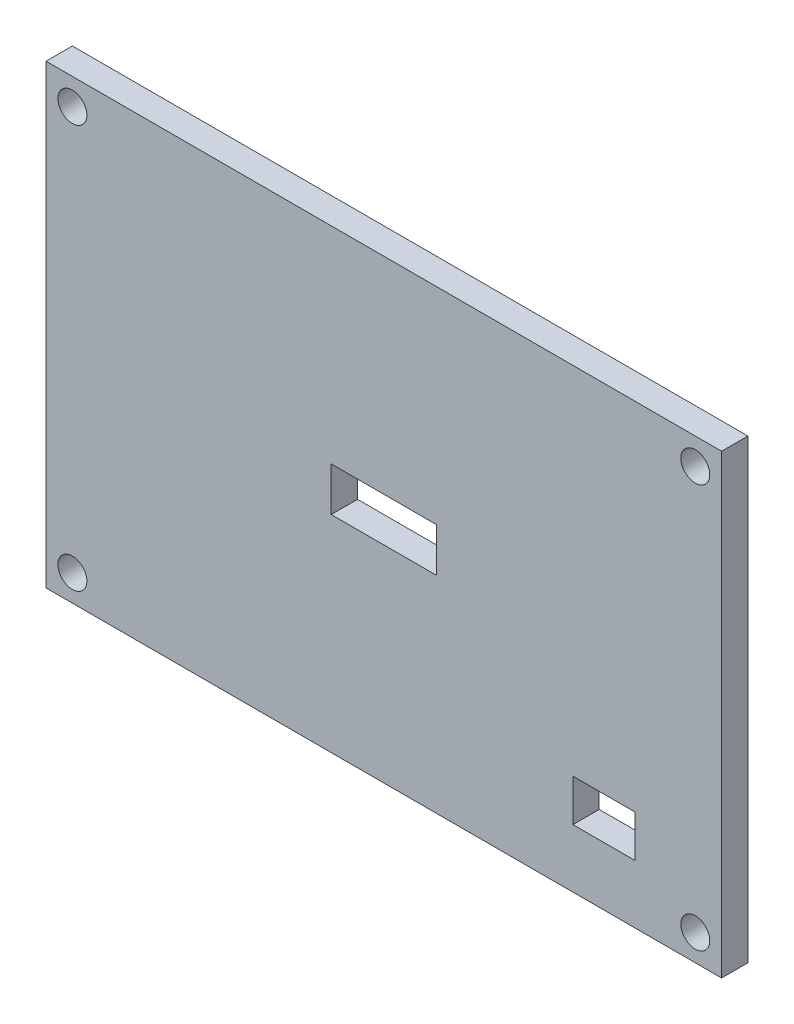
SolidWorks part; units mm, degrees
ref_plane "Alzado" through (0, 0, 0) normal (0, 0, 1) x (1, 0, 0)
ref_plane "Planta" through (0, 0, 0) normal (0, 1, 0) x (1, 0, 0)
ref_plane "Vista lateral" through (0, 0, 0) normal (1, 0, 0) x (0, 0, -1)
sketch "Croquis1" plane through (0, 0, 0) normal (0, 0, 1) x (1, 0, 0)
  line L0 (0, 0) -> (17.082, 0) construction
  line L1 (-38.5, -26) -> (38.5, -26)
  line L2 (-38.5, -26) -> (-38.5, 26)
  line L3 (-38.5, 26) -> (38.5, 26)
  line L4 (38.5, -26) -> (38.5, 26)
  line L5 (-38.5, -26) -> (38.5, 26) construction
  line L6 (-38.5, 26) -> (38.5, -26) construction
  line L7 (0, 0) -> (0, 14.9342) construction
  line L9 (-6, -2.5) -> (6, -2.5)
  line L10 (-6, -2.5) -> (-6, 2.5)
  line L11 (-6, 2.5) -> (6, 2.5)
  line L12 (6, -2.5) -> (6, 2.5)
  line L13 (-6, -2.5) -> (6, 2.5) construction
  line L14 (-6, 2.5) -> (6, -2.5) construction
  line L15 (28.6303, -19.3347) -> (21.5498, -19.3347)
  line L16 (28.6303, -19.3347) -> (28.6303, -14.5531)
  line L17 (28.6303, -14.5531) -> (21.5498, -14.5531)
  line L18 (21.5498, -19.3347) -> (21.5498, -14.5531)
  circle A0 centre (-35.5, 23) radius 1.65
  circle A1 centre (35.5, 23) radius 1.65
  circle A2 centre (35.5, -23) radius 1.65
  circle A3 centre (-35.5, -23) radius 1.65
  point P0 (0, 0)
  dimension "D4" = 3.3
  dimension "D1" = 52
  dimension "D2" = 77
  dimension "D3" = 3
  dimension "D5" = 3
  dimension "D6" = 5
  dimension "D7" = 12
  dimension "D8" = 9.8697
extrude "Saliente-Extruir1" add sketch "Croquis1" along normal blind 3
